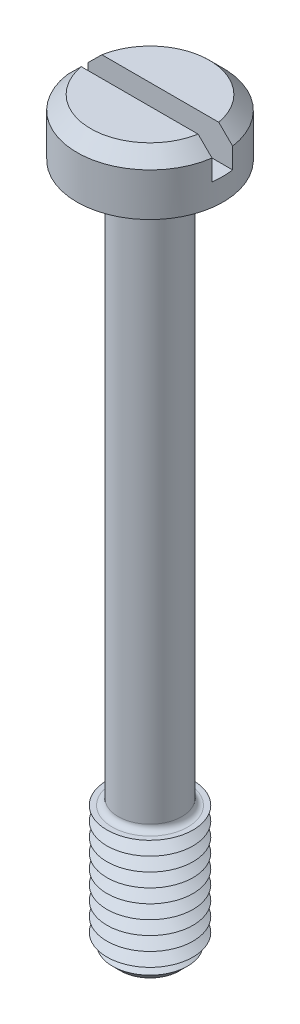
SolidWorks part; units mm, degrees
ref_plane "Front Plane" through (0, 0, 0) normal (0, 0, 1) x (1, 0, 0)
ref_plane "Top Plane" through (0, 0, 0) normal (0, 1, 0) x (1, 0, 0)
ref_plane "Right Plane" through (0, 0, 0) normal (1, 0, 0) x (0, 0, -1)
sketch "Sketch1" plane through (0, 0, 0) normal (0, 1, 0) x (1, 0, 0)
  circle A0 centre (0, 0) radius 4.25
  dimension "D1" = 8.5
extrude "Boss-Extrude1" add sketch "Sketch1" along normal blind 3.3
sketch "Sketch2" plane through (0, 0, 0) normal (0, -1, 0) x (1, 0, 0)
  circle A0 centre (0, 0) radius 1.85
  dimension "D1" = 3.7
extrude "Boss-Extrude2" add sketch "Sketch2" along normal blind 40
sketch "Sketch3" plane through (0, -40, 0) normal (0, -1, 0) x (1, 0, 0)
  circle A0 centre (0, 0) radius 2.5
  dimension "D1" = 5
extrude "Boss-Extrude3" add sketch "Sketch3" against normal blind 7.5
chamfer "Chamfer1" distance 0.8 angle 45 1 edges at (0, -40, -2.5)
sketch "Sketch4" plane through (0, 0, 0) normal (1, 0, 0) x (0, 0, -1)
  line L0 (0, -6.5871) -> (0, -12.0372) construction
sketch "Sketch5" plane through (0, 0, 0) normal (1, 0, 0) x (0, 0, -1)
  line L0 (-2.5, -32.5) -> (-1.8072, -32.9)
  line L1 (-1.8072, -32.9) -> (-2.5, -33.3)
  line L2 (-2.5, -32.5) -> (-2.5, -39.2) construction
  line L3 (-2.5, -33.3) -> (-2.5, -32.5)
  dimension "D1" = 0.8
revolve "Cut-Revolve1" cut sketch "Sketch5" angle 360 about L0
pattern_linear "LPattern1" count 9 spacing 0.8 along (0, -1, 0) of "Cut-Revolve1"
fillet "Fillet1" radius 0.35 2 edges at (0, -32.5, -1.85) (0, 0, -1.85)
chamfer "Chamfer2" distance 0.8 angle 45 1 edges at (0, 3.3, 4.25)
sketch "Sketch6" plane through (0, 3.3, 0) normal (0, 1, 0) x (1, 0, 0)
  line L1 (4.25, -0.6) -> (-4.25, -0.6)
  line L2 (4.25, -0.6) -> (4.25, 0.6)
  line L3 (4.25, 0.6) -> (-4.25, 0.6)
  line L4 (-4.25, -0.6) -> (-4.25, 0.6)
  line L5 (4.25, -0.6) -> (-4.25, 0.6) construction
  line L6 (4.25, 0.6) -> (-4.25, -0.6) construction
  circle A0 centre (0, 0) radius 4.25 construction
  point P0 (0, 0)
  dimension "D1" = 1.2
extrude "Cut-Extrude1" cut sketch "Sketch6" against normal blind 2
